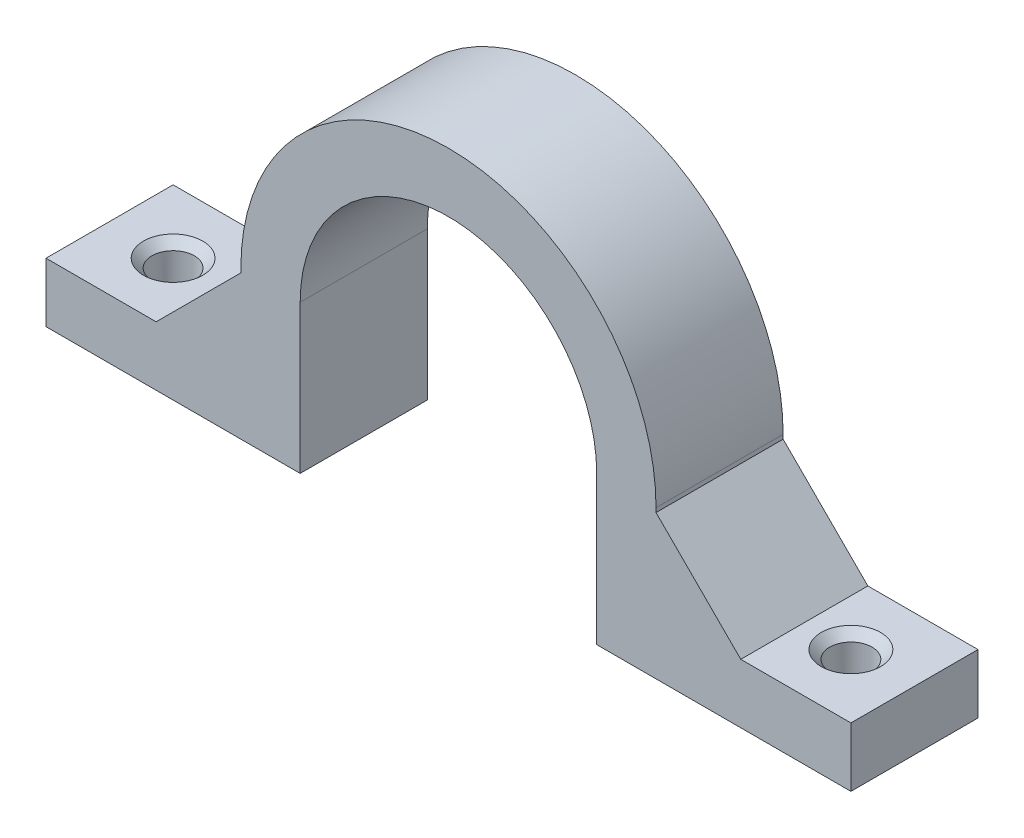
SolidWorks part; units mm, degrees
ref_plane "Plan de face" through (0, 0, 0) normal (0, 0, 1) x (1, 0, 0)
ref_plane "Plan de dessus" through (0, 0, 0) normal (0, 1, 0) x (1, 0, 0)
ref_plane "Plan de droite" through (0, 0, 0) normal (1, 0, 0) x (0, 0, -1)
sketch "Esquisse1" plane through (0, 0, 0) normal (0, 0, 1) x (1, 0, 0)
  line L0 (0, 0) -> (30, 0)
  line L1 (30, 0) -> (30, 17.5)
  line L2 (65, 17.5) -> (65, 0)
  line L3 (65, 0) -> (95, 0)
  line L4 (0, 7) -> (23, 7)
  line L5 (23, 7) -> (23, 17.5)
  line L6 (72, 17.5) -> (72, 7)
  line L7 (72, 7) -> (95, 7)
  line L8 (0, 7) -> (0, 0)
  line L9 (95, 7) -> (95, 0)
  arc A0 (30, 17.5) -> (65, 17.5) centre (47.5, 17.5) cw
  circle A1 centre (47.5, 17.5) radius 17.5 construction
  arc A2 (23, 17.5) -> (72, 17.5) centre (47.5, 17.5) cw
  circle A3 centre (47.5, 17.5) radius 10.5 construction
  point P6 (47.5, 35)
  dimension "D3" = 17.5
  dimension "D4" = 35
  dimension "D1" = 30
  dimension "D5" = 35
  dimension "D6" = 7
extrude "Boss.-Extru.1" add sketch "Esquisse1" along normal blind 15
chamfer "Chanfrein1" distance 10 angle 45 2 edges at (23, 7, 7.5) (72, 7, 7.5)
sketch "Esquisse2" plane through (0, 7, 0) normal (0, 1, 0) x (1, 0, 0)
  line L0 (95, -15) -> (95, 0) construction
  line L1 (95, 0) -> (82, 0) construction
  line L2 (0, -15) -> (0, 0) construction
  line L3 (13, 0) -> (0, 0) construction
  circle A0 centre (87.5, -7.5) radius 2.5
  circle A1 centre (7.5, -7.5) radius 2.5
  dimension "D1" = 5
  dimension "D2" = 7.5
  dimension "D3" = 7.5
  dimension "D4" = 5
  dimension "D5" = 7.5
  dimension "D6" = 7.5
extrude "Enlèv. mat.-Extru.1" cut sketch "Esquisse2" against normal blind 15
chamfer "Chanfrein2" distance 1 angle 45 2 edges at (87.5, 7, 10) (7.5, 7, 10)
